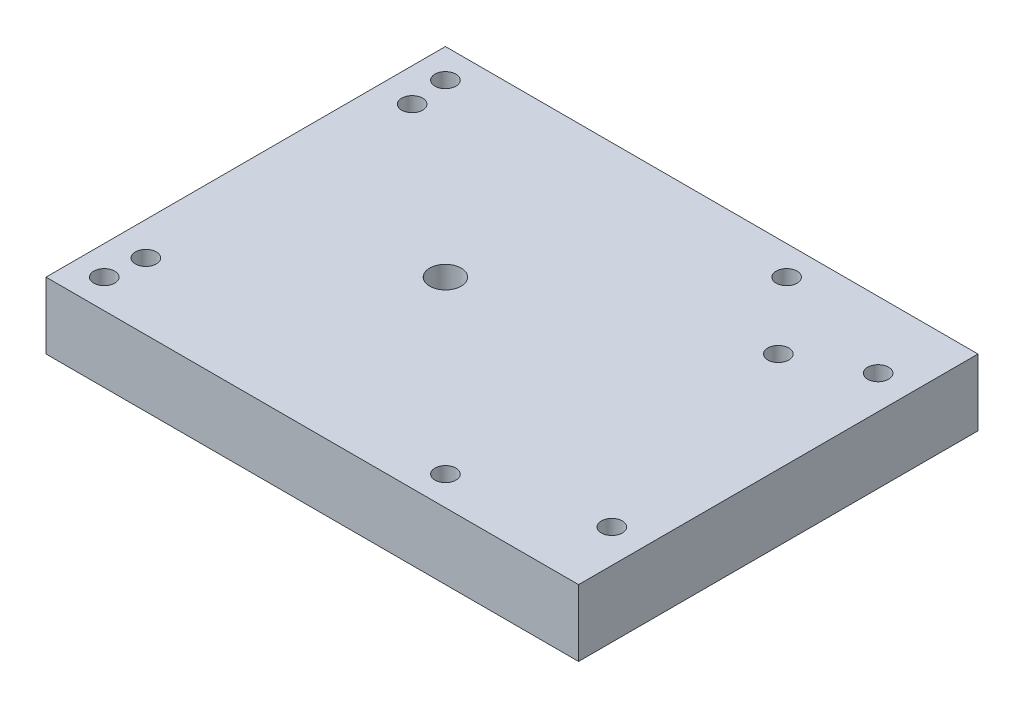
SolidWorks part; units mm, degrees
ref_plane "Front Plane" through (0, 0, 0) normal (0, 0, 1) x (1, 0, 0)
ref_plane "Top Plane" through (0, 0, 0) normal (0, 1, 0) x (1, 0, 0)
ref_plane "Right Plane" through (0, 0, 0) normal (1, 0, 0) x (0, 0, -1)
sketch "Sketch1" plane through (0, 0, 0) normal (0, 1, 0) x (1, 0, 0)
  line L1 (-59.6395, 26.8631) -> (41.9605, 26.8631)
  line L2 (-59.6395, 26.8631) -> (-59.6395, -49.3369)
  line L3 (-59.6395, -49.3369) -> (41.9605, -49.3369)
  line L4 (41.9605, 26.8631) -> (41.9605, -49.3369)
  dimension "D1" = 101.6
  dimension "D2" = 76.2
extrude "Boss-Extrude1" add sketch "Sketch1" along normal blind 12.7
sketch "Sketch2" plane through (0, 12.7, 0) normal (0, 1, 0) x (1, 0, 0)
  line L0 (41.9605, 26.8631) -> (-59.6395, 26.8631) construction
  line L1 (-59.6395, 26.8631) -> (-59.6395, -49.3369) construction
  circle A0 centre (-21.5395, -11.2369) radius 3
  dimension "D3" = 6
  dimension "D1" = 38.1
  dimension "D2" = 38.1
extrude "Cut-Extrude1" cut sketch "Sketch2" against normal through all
sketch "Sketch3" plane through (0, 12.7, 0) normal (0, 1, 0) x (1, 0, 0)
  line L0 (41.9605, 26.8631) -> (-59.6395, 26.8631) construction
  line L1 (-59.6395, 26.8631) -> (-59.6395, -49.3369) construction
  line L2 (41.9605, -49.3369) -> (41.9605, 26.8631) construction
  line L3 (-59.6395, -49.3369) -> (41.9605, -49.3369) construction
  circle A0 centre (-53.2895, 14.1631) radius 2
  circle A1 centre (35.6105, 14.1631) radius 2
  circle A2 centre (35.6105, -36.6369) radius 2
  circle A3 centre (-53.2895, -36.6369) radius 2
  dimension "D3" = 4
  dimension "D6" = 4
  dimension "D9" = 4
  dimension "D12" = 4
  dimension "D1" = 12.7
  dimension "D2" = 6.35
  dimension "D4" = 6.35
  dimension "D5" = 12.7
  dimension "D7" = 6.35
  dimension "D8" = 12.7
  dimension "D10" = 12.7
  dimension "D11" = 6.35
extrude "Cut-Extrude2" cut sketch "Sketch3" against normal through all
sketch "Sketch4" plane through (0, 12.7, 0) normal (0, 1, 0) x (1, 0, 0)
  line L0 (41.9605, 26.8631) -> (-59.6395, 26.8631) construction
  line L1 (41.9605, -49.3369) -> (41.9605, 26.8631) construction
  circle A0 centre (22.9105, 7.8131) radius 2
  dimension "D1" = 4
  dimension "D2" = 19.05
  dimension "D3" = 19.05
extrude "Cut-Extrude3" cut sketch "Sketch4" against normal through all
sketch "Sketch5" plane through (0, 12.7, 0) normal (0, 1, 0) x (-1, 0, 0)
  line L0 (-41.9605, -26.8631) -> (59.6395, -26.8631) construction
  line L1 (59.6395, -26.8631) -> (59.6395, 49.3369) construction
  line L2 (59.6395, 49.3369) -> (-41.9605, 49.3369) construction
  circle A0 centre (54.0832, -21.3069) radius 2
  circle A1 centre (-11.0043, -21.3069) radius 2
  circle A2 centre (54.0832, 43.7806) radius 2
  circle A3 centre (-11.0043, 43.7806) radius 2
  dimension "D1" = 4
  dimension "D2" = 4
  dimension "D3" = 4
  dimension "D4" = 4
  dimension "D5" = 5.5562
  dimension "D6" = 5.5562
  dimension "D7" = 5.5562
  dimension "D8" = 5.5562
  dimension "D9" = 5.5562
  dimension "D10" = 5.5562
  dimension "D11" = 65.0875
  dimension "D12" = 65.0875
extrude "Cut-Extrude4" cut sketch "Sketch5" against normal blind 6.35
